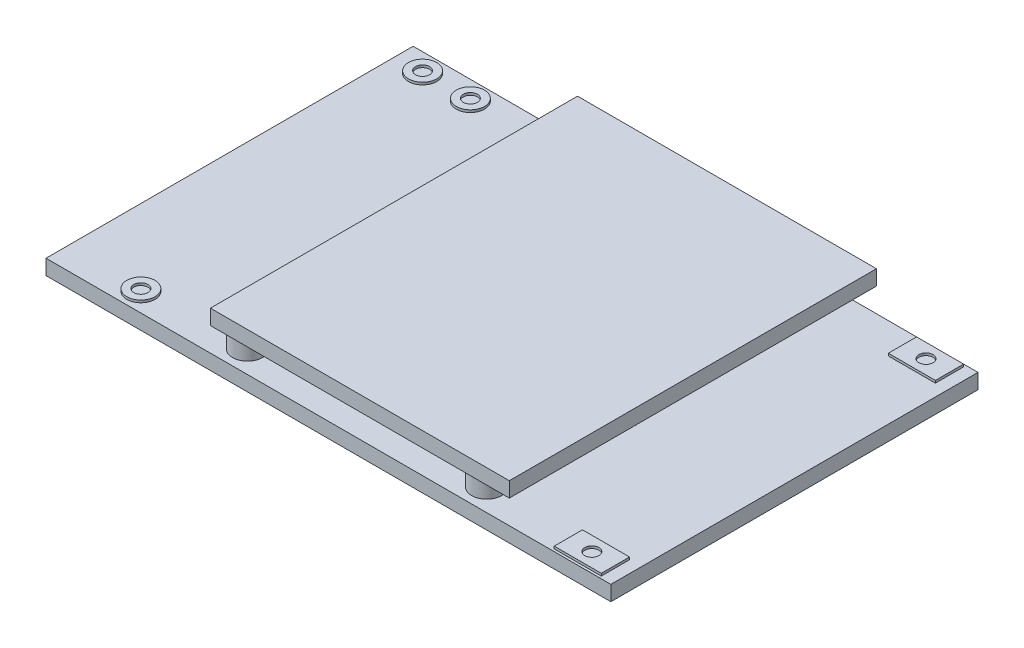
SolidWorks part; units mm, degrees
ref_plane "Front Plane" through (0, 0, 0) normal (0, 0, 1) x (1, 0, 0)
ref_plane "Top Plane" through (0, 0, 0) normal (0, 1, 0) x (1, 0, 0)
ref_plane "Right Plane" through (0, 0, 0) normal (1, 0, 0) x (0, 0, -1)
sketch "Sketch1" plane through (0, 0, 0) normal (0, 1, 0) x (1, 0, 0)
  line L1 (-30, -19.5) -> (30, -19.5)
  line L2 (-30, -19.5) -> (-30, 19.5)
  line L3 (-30, 19.5) -> (30, 19.5)
  line L4 (30, -19.5) -> (30, 19.5)
  line L5 (-30, -19.5) -> (30, 19.5) construction
  line L6 (-30, 19.5) -> (30, -19.5) construction
  point P0 (0, 0)
  dimension "D1" = 60
  dimension "D2" = 39
extrude "Boss-Extrude1" add sketch "Sketch1" along normal blind 1.6002
sketch "Sketch2" plane through (0, 1.6002, 0) normal (0, 1, 0) x (1, 0, 0)
  line L0 (-10.95, 0) -> (0, 0) construction
  line L1 (-10.95, 17.145) -> (14.45, 17.145) construction
  line L2 (-10.95, 17.145) -> (-10.95, -17.145) construction
  line L3 (-10.95, -17.145) -> (14.45, -17.145) construction
  line L4 (14.45, 17.145) -> (14.45, -17.145) construction
  line L5 (-30, 19.5) -> (-30, -19.5) construction
  circle A0 centre (-10.95, -17.145) radius 1.5875
  circle A1 centre (-10.95, 17.145) radius 1.5875
  circle A2 centre (14.45, 17.145) radius 1.5875
  circle A3 centre (14.45, -17.145) radius 1.5875
  dimension "D1" = 3.175
  dimension "D2" = 19.05
  dimension "D3" = 34.29
  dimension "D4" = 25.4
extrude "Boss-Extrude2" add sketch "Sketch2" along normal blind 2.54
sketch "Sketch3" plane through (0, 4.1402, 0) normal (0, 1, 0) x (1, 0, 0)
  line L0 (30, 19.5) -> (-30, 19.5) construction
  line L1 (-12.5375, 19.5) -> (19.2125, 19.5)
  line L2 (-12.5375, 19.5) -> (-12.5375, -19.5)
  line L3 (-12.5375, -19.5) -> (19.2125, -19.5)
  line L4 (19.2125, 19.5) -> (19.2125, -19.5)
  line L5 (-30, -19.5) -> (30, -19.5) construction
  circle A0 centre (-10.95, 17.145) radius 1.5875 construction
  dimension "D1" = 31.75
extrude "Boss-Extrude3" add sketch "Sketch3" along normal blind 1.6002
sketch "Sketch4" plane through (0, 1.6002, 0) normal (0, 1, 0) x (1, 0, 0)
  line L0 (30, 19.5) -> (-30, 19.5) construction
  line L1 (23.73, 19.246) -> (28.73, 19.246)
  line L2 (23.73, 19.246) -> (23.73, 16.246)
  line L3 (23.73, 16.246) -> (28.73, 16.246)
  line L4 (28.73, 19.246) -> (28.73, 16.246)
  line L9 (30, -19.5) -> (30, 19.5) construction
  line L10 (30, 0) -> (8.1896, 0) construction
  line L15 (-30, 19.5) -> (-30, -19.5) construction
  line L16 (28.73, 19.246) -> (23.73, 16.246) construction
  line L17 (28.73, -19.246) -> (28.73, -16.246)
  line L18 (23.73, -16.246) -> (28.73, -16.246)
  line L19 (23.73, -19.246) -> (23.73, -16.246)
  line L20 (23.73, -19.246) -> (28.73, -19.246)
  circle A0 centre (-27, 17.5) radius 1.5
  circle A1 centre (-21.92, 17.5) radius 1.5
  circle A3 centre (-27, 17.5) radius 0.75
  circle A4 centre (-21.92, 17.5) radius 0.75
  circle A5 centre (26.23, 17.746) radius 0.75
  circle A7 centre (26.23, -17.746) radius 0.75
  circle A8 centre (-21.92, -17.5) radius 0.75
  circle A10 centre (-21.92, -17.5) radius 1.5
  dimension "D6" = 3
  dimension "D9" = 1.5
  dimension "D1" = 3
  dimension "D2" = 5
  dimension "D3" = 0.254
  dimension "D4" = 1.27
  dimension "D5" = 5.08
  dimension "D7" = 2
  dimension "D8" = 3
extrude "Boss-Extrude4" add sketch "Sketch4" along normal blind 0.254
